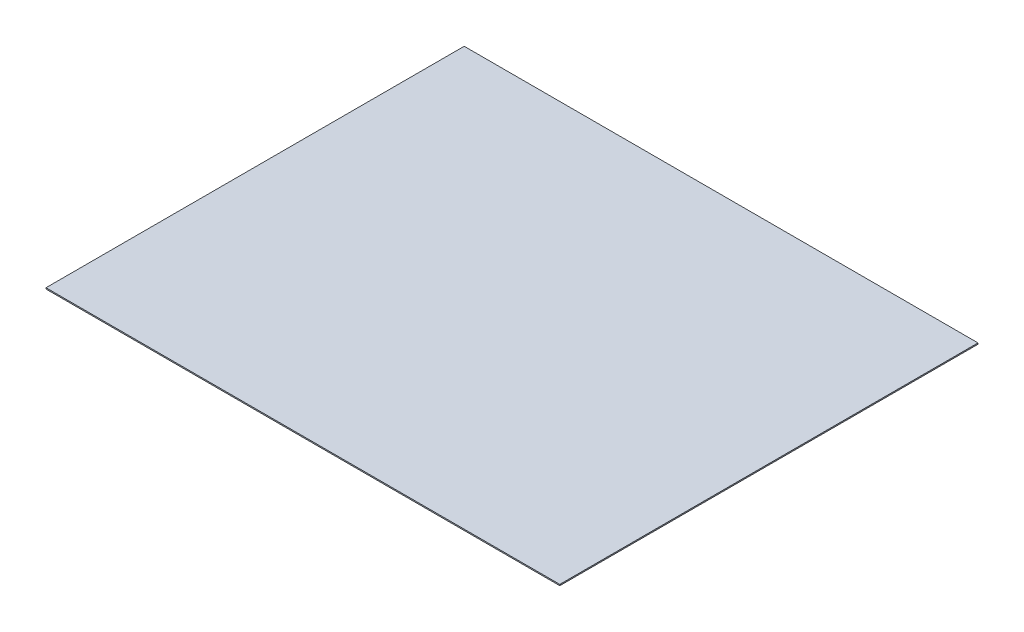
SolidWorks part; units mm, degrees
ref_plane "Front Plane" through (0, 0, 0) normal (0, 0, 1) x (1, 0, 0)
ref_plane "Top Plane" through (0, 0, 0) normal (0, 1, 0) x (1, 0, 0)
ref_plane "Right Plane" through (0, 0, 0) normal (1, 0, 0) x (0, 0, -1)
sketch "Sketch1" plane through (0, 0, 0) normal (0, 1, 0) x (1, 0, 0)
  line L1 (0, 0) -> (546.1, 0)
  line L2 (0, 0) -> (0, -444.5)
  line L3 (0, -444.5) -> (546.1, -444.5)
  line L4 (546.1, 0) -> (546.1, -444.5)
  dimension "D1" = 546.1
  dimension "D2" = 444.5
extrude "Boss-Extrude1" add sketch "Sketch1" along normal blind 1.27
